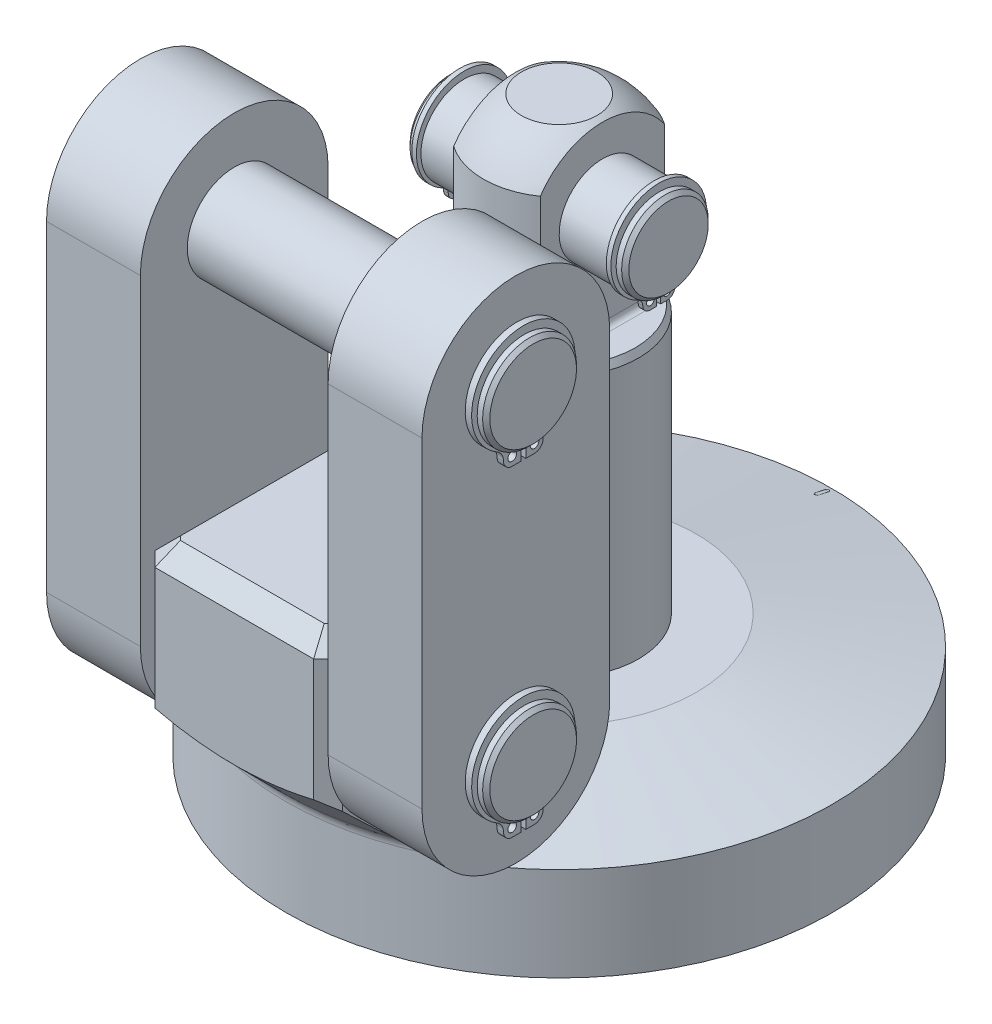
SolidWorks part; units mm, degrees
ref_plane "Front Plane" through (0, 0, 0) normal (0, 0, 1) x (1, 0, 0)
ref_plane "Top Plane" through (0, 0, 0) normal (0, 1, 0) x (1, 0, 0)
ref_plane "Right Plane" through (0, 0, 0) normal (1, 0, 0) x (0, 0, -1)
sketch "Sketch1" plane through (0, 0, 0) normal (0, 1, 0) x (1, 0, 0)
  line L0 (-13, 0) -> (13, 0)
  line L1 (13, 0) -> (13, -45)
  line L2 (13, -45) -> (-13, -45)
  line L3 (-13, -45) -> (-13, 0)
  line L4 (0, 1.05) -> (0, -22.05) construction
  dimension "D1" = 26
  dimension "D2" = 45
extrude "Extrude1" add sketch "Sketch1" along normal blind 42
sketch "S2D0003" plane through (0, 0, 0) normal (1, 0, 0) x (0, 0, -1)
  line L0 (0, 0) -> (0, 17)
  line L1 (-45, 0) -> (0, 0)
  line L2 (-45, 0) -> (-45, 11.4735)
  line L3 (0, 17) -> (-19, 17)
  line L4 (-19, 17) -> (-45, 11.4735)
  line L5 (0, 9.45) -> (0, -2.5987) construction
  line L6 (0, 42) -> (0, 0) construction
  line L8 (-45, 0) -> (0, 0) construction
  line L10 (-45, 42) -> (-45, 0) construction
  dimension "D1" = 17
  dimension "D2" = 12
  dimension "D3" = 38
sketch "S2D0004" plane through (0, 0, 0) normal (1, 0, 0) x (0, 0, -1)
  line L0 (-50, 26.2924) -> (-38.4318, 14.7242)
  line L1 (-37.846, 13.31) -> (-37.846, 0)
  line L2 (0, 16.6313) -> (0, -1.1122) construction
  line L3 (0, 42) -> (0, 0) construction
  line L5 (-45, 0) -> (0, 0) construction
  line L6 (-50, 26.2924) -> (-50, 0)
  line L7 (-50, 0) -> (-37.846, 0)
  line L8 (-45, 42) -> (-45, 0) construction
  arc A0 (-37.846, 13.31) -> (-38.4318, 14.7242) centre (-39.846, 13.31) ccw
  dimension "D4" = 2
  dimension "D1" = 75.692
  dimension "D2" = 13.31
  dimension "D3" = 45
  dimension "D5" = 5
sketch "Sketch4" plane through (0, 0, 0) normal (1, 0, 0) x (0, 0, -1)
  line L0 (0, 17) -> (19, 17)
  line L1 (19, 17) -> (19, 42)
  line L2 (19, 42) -> (0, 42)
  line L3 (0, 42) -> (0, 17)
  line L4 (0, 21.6) -> (0, 8.4) construction
  line L5 (0, 42) -> (0, 0) construction
  line L6 (-45, 42) -> (0, 42) construction
  dimension "D1" = 38
  dimension "D2" = 25
revolve "Cut-Revolve5" cut sketch "Sketch4" angle 360 about L4
revolve "Revolve1" add sketch "S2D0003" angle 360 about L5
revolve "Cut-Revolve4" cut sketch "S2D0004" angle 360 about L2
sketch "Sketch7" plane through (13, 0, 0) normal (1, 0, 0) x (0, 0, -1)
  line L0 (-37.846, 0) -> (37.846, 0) construction
  circle A0 centre (-32, 29) radius 6.5
  dimension "D1" = 13
  dimension "D2" = 29
  dimension "D3" = 32
extrude "Cut-Extrude3" cut sketch "Sketch7" against normal through all
fillet "Fillet1" radius 3.5052 2 edges at (-13, 29.5, 13.8564) (13, 29.5, 13.8564)
fillet "Fillet2" radius 4.7498 5 edges at (-11.296, 16.6296, 17.3972) (0, 17, 19) (11.333, 16.6213, 17.4197)
chamfer "Chamfer1" distance 2.0066 angle 45 2 edges at (-13, 32.5663, 45) (13, 32.5663, 45)
chamfer "Chamfer2" distance 2.5 angle 45 8 edges at (-13, 42, 31.6988) (-11.3793, 42, 17.4487) (0, 42, 19) (11.3793, 42, 17.4487) (-11.9967, 42, 43.9967) (13, 42, 31.6988) (11.9967, 42, 43.9967) (0, 42, 45)
ref_plane "Plane1" through (0, 0, 32) normal (0, 0, 1) x (1, 0, 0)
sketch "Sketch8" plane through (0, 0, 32) normal (0, 0, 1) x (1, 0, 0)
  line L0 (13, 29) -> (13, 15.5)
  line L1 (14.14, 14.36) -> (27.64, 14.36)
  line L2 (27.64, 14.36) -> (27.64, 29)
  line L3 (27.64, 29) -> (13, 29)
  line L4 (5.637, 29) -> (19.4125, 29) construction
  line L5 (-13, 29) -> (13, 29) construction
  line L6 (13, 42) -> (13, 23.1326) construction
  line L7 (0, 0) -> (0, 26.6501) construction
  line L8 (-27.64, 29) -> (-13, 29)
  line L9 (-27.64, 14.36) -> (-27.64, 29)
  line L10 (-14.14, 14.36) -> (-27.64, 14.36)
  line L11 (-13, 29) -> (-13, 15.5)
  arc A0 (13, 15.5) -> (14.14, 14.36) centre (14.14, 15.5) ccw
  arc A1 (-13, 15.5) -> (-14.14, 14.36) centre (-14.14, 15.5) cw
  dimension "D4" = 1.14
  dimension "D2" = 29.28
  dimension "D3" = 14.64
revolve "Cut-Revolve6" cut sketch "Sketch8" angle 360 about L4
sketch "Sketch10" plane through (0, 0, 0) normal (1, 0, 0) x (0, 0, -1)
  line L0 (0, 17) -> (0, 79.3)
  line L1 (0, 79.3) -> (5.2307, 79.3)
  line L2 (10.5, 74.3095) -> (10.5, 54.1723)
  line L3 (10.5, 54.1723) -> (11, 53.1)
  line L4 (11, 53.1) -> (11, 17)
  line L5 (11, 17) -> (0, 17)
  line L6 (0, 44.745) -> (0, 7.55) construction
  line L7 (22.759, -19) -> (-24.5324, -19) construction
  line L9 (19, 17) -> (-13.1229, 17) construction
  arc A0 (10.5, 74.3095) -> (5.2307, 79.3) centre (0, 68.5) ccw
  circle A1 centre (0, 68.5) radius 6 construction
  dimension "D2" = 12
  dimension "D3" = 12
  dimension "D5" = 87.5
  dimension "D1" = 10.8
  dimension "D4" = 36
  dimension "D6" = 22
  dimension "D7" = 21
  dimension "D8" = 25
  dimension "D9" = 26.2
  dimension "D10" = 36.1
  dimension "D11" = 62.3
revolve "Revolve2" add sketch "Sketch10" angle 360 about L6
sketch "Sketch12" plane through (0, 0, 0) normal (0, 0, 1) x (1, 0, 0)
  line L0 (6, 79.3) -> (11, 79.3)
  line L1 (11, 79.3) -> (11, 54.1)
  line L2 (11, 54.1) -> (6.8, 54.1)
  line L3 (6, 54.9) -> (6, 79.3)
  line L4 (5.2307, 79.3) -> (-5.2307, 79.3) construction
  line L5 (11, 17) -> (11, 53.1) construction
  line L6 (-6, 54.9) -> (-6, 79.3)
  line L7 (-11, 54.1) -> (-6.8, 54.1)
  line L8 (0, 38.525) -> (0, 26.975) construction
  line L9 (-11, 79.3) -> (-11, 54.1)
  line L10 (-6, 79.3) -> (-11, 79.3)
  arc A0 (6, 54.9) -> (6.8, 54.1) centre (6.8, 54.9) ccw
  arc A1 (-6, 54.9) -> (-6.8, 54.1) centre (-6.8, 54.9) cw
  dimension "D3" = 0.8
  dimension "D1" = 12
  dimension "D2" = 25.2
extrude "Cut-Extrude5" cut sketch "Sketch12" against normal mid plane 22
sketch "Sketch14" plane through (6, 0, 0) normal (1, 0, 0) x (0, 0, -1)
  line L0 (5.2307, 79.3) -> (-5.2307, 79.3) construction
  circle A0 centre (0, 68.5) radius 6
  dimension "D2" = 12
  dimension "D1" = 10.8
extrude "Cut-Extrude7" cut sketch "Sketch14" against normal up to next
sketch "S2D0005" plane through (13, 0, 0) normal (1, 0, 0) x (0, 0, -1)
  line L0 (-45.0046, 73.4987) -> (-45, 28.9987)
  line L1 (-19.0046, 73.5013) -> (-19, 29.0013)
  line L2 (-32.0046, 73.5) -> (-32, 29) construction
  line L3 (0, 68.5) -> (-0.0006, 73.5038) construction
  line L4 (-0.0006, 73.5038) -> (-32.0046, 73.5) construction
  arc A0 (-19.0046, 73.5013) -> (-45.0046, 73.4987) centre (-32.0046, 73.5) ccw
  arc A1 (-45, 28.9987) -> (-19, 29.0013) centre (-32, 29) ccw
  circle A2 centre (-32.0046, 73.5) radius 6.5
  circle A3 centre (-32, 29) radius 6.5
  circle A6 centre (-32, 29) radius 6.5 construction
  dimension "D2" = 44.5
  dimension "D1" = 26
  dimension "D3" = 32.004
  dimension "D4" = 5.0038
extrude "Extrude2" add sketch "S2D0005" along normal blind 13
sketch "S2D0006" plane through (0, 0, 0) normal (0, 0, 1) x (1, 0, 0)
  line L0 (-13.15, 74.5) -> (13.15, 74.5)
  line L1 (15.15, 74) -> (15.15, 68.5)
  line L2 (14.65, 74.5) -> (15.15, 74)
  line L3 (13.89, 74.5) -> (14.65, 74.5)
  line L4 (13.89, 74.125) -> (13.89, 74.5)
  line L5 (13.15, 74.125) -> (13.89, 74.125)
  line L6 (13.15, 74.5) -> (13.15, 74.125)
  line L7 (15.15, 68.5) -> (-15.15, 68.5)
  line L8 (-13.15, 74.5) -> (-13.15, 74.125)
  line L9 (-13.15, 74.125) -> (-13.89, 74.125)
  line L10 (-13.89, 74.125) -> (-13.89, 74.5)
  line L11 (-13.89, 74.5) -> (-14.65, 74.5)
  line L12 (-14.65, 74.5) -> (-15.15, 74)
  line L13 (-15.15, 74) -> (-15.15, 68.5)
  line L14 (-8.415, 68.5) -> (8.415, 68.5) construction
  line L15 (-6, 68.5) -> (6, 68.5) construction
  line L16 (0, 40.8686) -> (0, 24.9357) construction
  line L17 (0, 54.1723) -> (0, 74.3095) construction
  line L18 (6, 74.5) -> (-6, 74.5) construction
  dimension "D1" = 30.3
  dimension "D3" = 0.74
  dimension "D4" = 11.25
  dimension "D5" = 26.3
  dimension "D6" = 0.5
  dimension "D7" = 45
revolve "Revolve3" add sketch "S2D0006" angle 360 about L14
ref_plane "Plane2" through (0, 0, 32) normal (0, 0, 1) x (1, 0, 0)
sketch "Sketch18" plane through (0, 0, 32) normal (0, 0, 1) x (1, 0, 0)
  line L0 (-26.15, 35.5) -> (26.15, 35.5)
  line L1 (28.4, 35) -> (28.4, 29)
  line L2 (27.9, 35.5) -> (28.4, 35)
  line L3 (27.15, 35.5) -> (27.9, 35.5)
  line L4 (27.15, 34.945) -> (27.15, 35.5)
  line L5 (26.15, 34.945) -> (27.15, 34.945)
  line L6 (26.15, 35.5) -> (26.15, 34.945)
  line L7 (-26.15, 35.5) -> (-26.15, 34.945)
  line L8 (-26.15, 34.945) -> (-27.15, 34.945)
  line L9 (-27.15, 34.945) -> (-27.15, 35.5)
  line L10 (-27.15, 35.5) -> (-27.9, 35.5)
  line L11 (-27.9, 35.5) -> (-28.4, 35)
  line L12 (-28.4, 35) -> (-28.4, 29)
  line L13 (-13.915, 29) -> (13.915, 29) construction
  line L14 (-13, 29) -> (26, 29) construction
  line L15 (0, 28.7058) -> (0, -18.8155) construction
  line L16 (-28.4, 29) -> (28.4, 29)
  line L17 (26, 35.5) -> (-13, 35.5) construction
  dimension "D2" = 56.8
  dimension "D3" = 11.89
  dimension "D4" = 1
  dimension "D5" = 52.3
  dimension "D6" = 0.5
  dimension "D7" = 45
revolve "Revolve4" add sketch "Sketch18" angle 360 about L13
sketch "Sketch20" plane through (13.15, 0, 0) normal (1, 0, 0) x (0, 0, -1)
  line L0 (0.2794, 60.8372) -> (1.169, 60.8372)
  line L1 (0.2794, 63.0722) -> (0.2794, 60.8372)
  line L2 (-0.2794, 63.0722) -> (-0.2794, 60.8372)
  line L3 (-0.2794, 60.8372) -> (-1.169, 60.8372)
  line L4 (0, 30.527) -> (0, 23.2449) construction
  arc A0 (0.2794, 63.0722) -> (-0.2794, 63.0722) centre (0, 68.5) ccw
  arc A1 (2.8303, 62.8456) -> (-2.8303, 62.8456) centre (0, 68.8348) ccw
  circle A2 centre (0, 68.5) radius 6 construction
  circle A3 centre (1.169, 61.8782) radius 0.5205
  arc A4 (2.21, 61.8724) -> (1.169, 60.8372) centre (1.169, 61.8782) cw
  arc A5 (-2.21, 61.8724) -> (-2.8303, 62.8456) centre (-3.2931, 61.8663) ccw
  arc A6 (-2.21, 61.8724) -> (-1.169, 60.8372) centre (-1.169, 61.8782) ccw
  circle A7 centre (-1.169, 61.8782) radius 0.5205
  arc A8 (2.21, 61.8724) -> (2.8303, 62.8456) centre (3.2931, 61.8663) cw
  dimension "D1" = 0.5587
  dimension "D2" = 5.435
  dimension "D3" = 6.6242
  dimension "D4" = 0.3348
  dimension "D6" = 1.041
  dimension "D9" = 1.041
  dimension "D10" = 1.0832
  dimension "D7" = 2.338
  dimension "D8" = 6.6218
extrude "Extrude4" add sketch "Sketch20" along normal blind 0.635
sketch "Sketch21" plane through (26.15, 0, 0) normal (1, 0, 0) x (0, 0, -1)
  line L0 (-31.6562, 20.4127) -> (-30.4501, 20.4129)
  line L1 (-31.6565, 23.1556) -> (-31.6562, 20.4127)
  line L2 (-32.3423, 23.1555) -> (-32.342, 20.4127)
  line L3 (-32.342, 20.4127) -> (-33.5481, 20.4125)
  line L4 (-31.9979, 8.8095) -> (-31.9973, 2.732) construction
  line L5 (-45.0046, 73.4987) -> (-45, 28.9987) construction
  arc A0 (-31.6565, 23.1556) -> (-32.3423, 23.1555) centre (-32, 29) ccw
  arc A1 (-28.3621, 23.1721) -> (-35.6367, 23.1714) centre (-32, 29.3425) ccw
  circle A2 centre (-30.4502, 21.6069) radius 0.597
  arc A3 (-29.2562, 21.6069) -> (-30.4501, 20.4129) centre (-30.4502, 21.6069) cw
  arc A4 (-29.2562, 21.6069) -> (-28.3621, 23.1721) centre (-27.4394, 21.607) cw
  arc A5 (-34.7422, 21.6064) -> (-35.6367, 23.1714) centre (-36.5591, 21.6061) ccw
  arc A6 (-34.7422, 21.6064) -> (-33.5481, 20.4125) centre (-33.5482, 21.6065) ccw
  circle A7 centre (-33.5482, 21.6065) radius 0.597
  circle A8 centre (-32, 29) radius 6.5 construction
  dimension "D1" = 5.8545
  dimension "D2" = 7.163
  dimension "D3" = 0.3425
  dimension "D7" = 1.194
  dimension "D8" = 1.194
  dimension "D9" = 7.3935
  dimension "D10" = 1.8168
  dimension "D4" = 0.6857
  dimension "D6" = 3.098
extrude "Extrude5" add sketch "Sketch21" along normal blind 0.889
pattern_linear "LPattern1" count 2 spacing 44.5 along (0, 1, 0.0001) of "Extrude5", "Revolve4"
mirror "Mirror1" about plane through (0, 0, 0) normal (1, 0, 0) of "Extrude5", "LPattern1", "Extrude4", "Extrude2"
sketch "Sketch22" plane through (0, 0, 0) normal (1, 0, 0) x (0, 0, -1)
  line L0 (37.5085, 13.8429) -> (35.1799, 14.3378) construction
  line L1 (37.846, 12.9942) -> (19, 17) construction
  line L2 (37.3569, 13.0981) -> (35.4006, 13.5139) construction
  line L3 (35.803, 14.2054) -> (37.2706, 13.8934) construction
  line L5 (35.6367, 13.4229) -> (37.1043, 13.1109)
  line L6 (35.0205, 14.3717) -> (38.0531, 13.7271)
  arc A0 (35.0205, 14.3717) -> (35.6367, 13.4229) centre (35.803, 14.2054) ccw
  arc A1 (37.1043, 13.1109) -> (38.0531, 13.7271) centre (37.2706, 13.8934) ccw
  dimension "D2" = 1.6
  dimension "D1" = 0.76
  dimension "D3" = 2
  dimension "D4" = 0.5
revolve "Cut-Revolve7" cut sketch "Sketch22" angle 360 about L6
